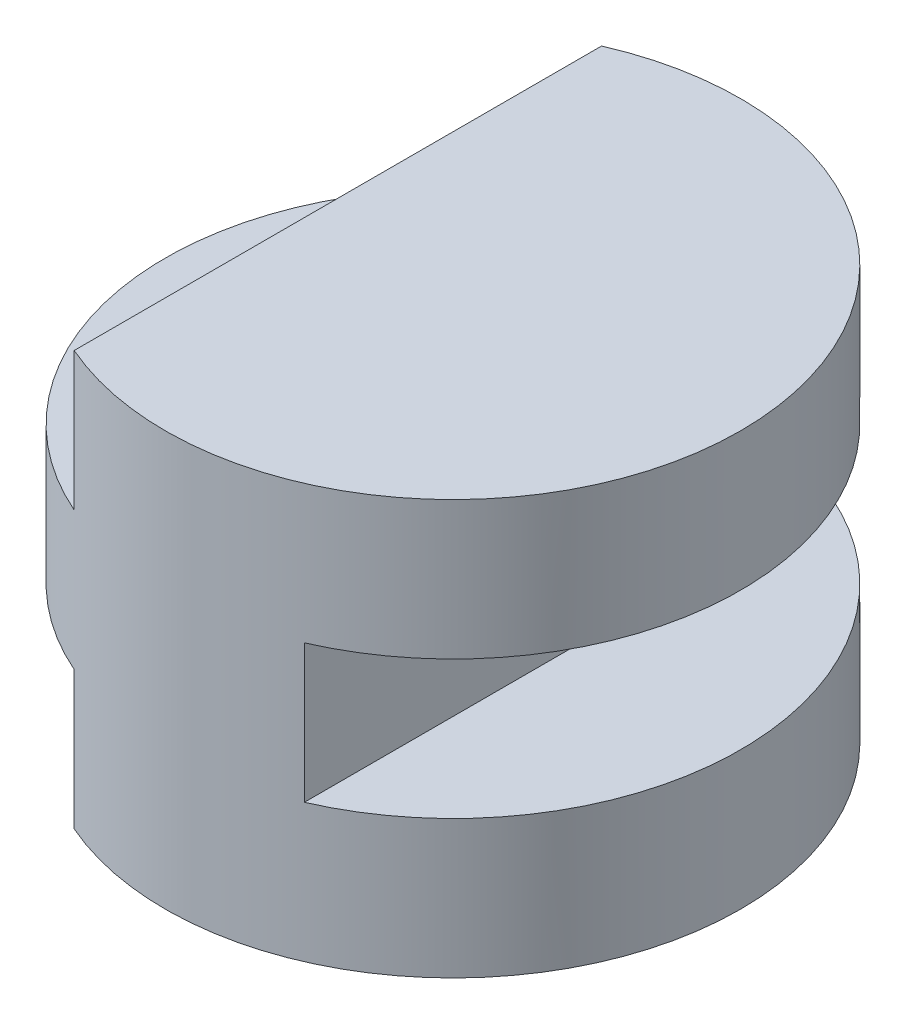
SolidWorks part; units mm, degrees
ref_plane "前视基准面" through (0, 0, 0) normal (0, 0, 1) x (1, 0, 0)
ref_plane "上视基准面" through (0, 0, 0) normal (0, 1, 0) x (1, 0, 0)
ref_plane "右视基准面" through (0, 0, 0) normal (1, 0, 0) x (0, 0, -1)
sketch "草图2" plane through (0, 0, 0) normal (0, 1, 0) x (1, 0, 0)
  circle A0 centre (0, 0) radius 50
extrude "拉伸1" add sketch "草图2" along normal blind 72
sketch "草图3" plane through (0, 0, 0) normal (0, 0, 1) x (1, 0, 0)
  line L0 (0, 0) -> (0, 72) construction
  line L1 (50, 72) -> (-50, 72) construction
  line L2 (0, 72) -> (0, 36) construction
  line L3 (0, 36) -> (-67.5862, 36) construction
  line L4 (-20, -6.5747) -> (-20, 24)
  line L5 (20, 48) -> (65.5172, 48)
  line L6 (20, 48) -> (20, 24)
  line L7 (20, 24) -> (65.5172, 24)
  line L8 (65.5172, 48) -> (65.5172, 24)
  line L9 (-74.023, 78.5747) -> (-20, 78.5747)
  line L10 (-74.023, 78.5747) -> (-74.023, 48)
  line L11 (-74.023, 48) -> (-20, 48)
  line L12 (-20, 78.5747) -> (-20, 48)
  line L13 (-74.023, 24) -> (-20, 24)
  line L14 (-74.023, -6.5747) -> (-74.023, 24)
  line L15 (-74.023, -6.5747) -> (-20, -6.5747)
  dimension "D1" = 12
  dimension "D2" = 20
  dimension "D3" = 12
extrude "切除-拉伸1" cut sketch "草图3" against normal mid plane 100
